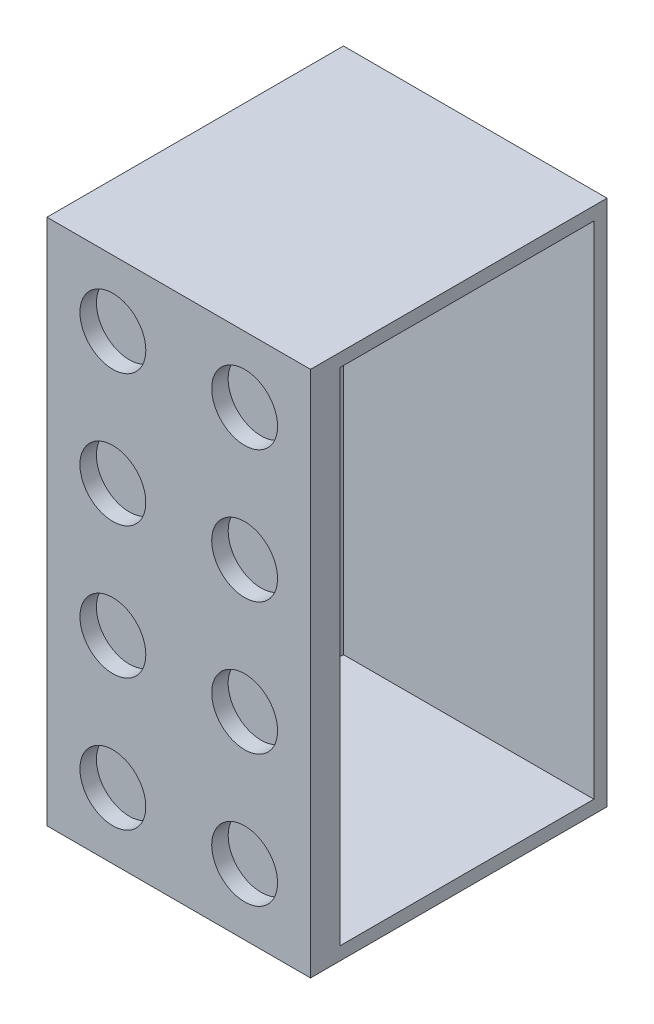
SolidWorks part; units mm, degrees
ref_plane "Front Plane" through (0, 0, 0) normal (0, 0, 1) x (1, 0, 0)
ref_plane "Top Plane" through (0, 0, 0) normal (0, 1, 0) x (1, 0, 0)
ref_plane "Right Plane" through (0, 0, 0) normal (1, 0, 0) x (0, 0, -1)
sketch "Sketch1" plane through (0, 0, 0) normal (0, 0, 1) x (1, 0, 0)
  line L1 (0, 0) -> (50.8, 0)
  line L2 (0, 0) -> (0, 101.6)
  line L3 (0, 101.6) -> (50.8, 101.6)
  line L4 (50.8, 0) -> (50.8, 101.6)
  dimension "D1" = 101.6
  dimension "D2" = 50.8
extrude "Boss-Extrude1" add sketch "Sketch1" along normal blind 57.15
sketch "Sketch3" plane through (0, 0, 57.15) normal (0, 0, 1) x (1, 0, 0)
  line L0 (0, 101.6) -> (0, 0) construction
  line L1 (50.8, 101.6) -> (0, 101.6) construction
  line L2 (0, 0) -> (50.8, 0) construction
  line L3 (25.4, 101.6) -> (25.4, 0)
  line L5 (12.7, 152.4) -> (12.7, 0)
  line L6 (38.1, 101.6) -> (38.1, 0)
  line L7 (50.8, 101.6) -> (50.8, 0)
  line L8 (63.5, 101.6) -> (63.5, 0)
  line L9 (76.2, 101.6) -> (76.2, 0)
  line L10 (88.9, 101.6) -> (88.9, 0)
  line L11 (0, 12.7) -> (50.8, 12.7)
  line L12 (50.8, 0) -> (50.8, 101.6) construction
  line L13 (0, 25.4) -> (50.8, 25.4)
  line L14 (0, 38.1) -> (50.8, 38.1)
  line L15 (0, 50.8) -> (50.8, 50.8)
  line L16 (0, 63.5) -> (50.8, 63.5)
  line L17 (0, 63.6141) -> (50.8, 63.6141)
  line L18 (0, 76.2) -> (50.8, 76.2)
  line L19 (0, 88.9) -> (50.8, 88.9)
  line L20 (0, 101.6) -> (50.8, 101.6)
  line L21 (0, 114.3) -> (50.8, 114.3)
  line L22 (0, 127) -> (50.8, 127)
  line L23 (0, 139.7) -> (50.8, 139.7)
  circle A0 centre (12.7, 139.7) radius 6.35
  circle A2 centre (38.1, 139.7) radius 6.35
  circle A4 centre (63.5, 139.7) radius 2.54
  circle A6 centre (88.9, 139.7) radius 2.54
  circle A7 centre (88.9, 114.3) radius 2.54
  circle A8 centre (63.5, 114.3) radius 2.54
  circle A9 centre (38.1, 114.3) radius 6.35
  circle A10 centre (12.7, 114.3) radius 6.35
  circle A11 centre (88.9, 88.9) radius 2.54
  circle A12 centre (63.5, 88.9) radius 2.54
  circle A13 centre (38.1, 88.9) radius 6.35
  circle A14 centre (12.7, 88.9) radius 6.35
  circle A15 centre (88.9, 63.5) radius 2.54
  circle A16 centre (63.5, 63.5) radius 2.54
  circle A17 centre (38.1, 63.5) radius 6.35
  circle A18 centre (12.7, 63.5) radius 6.35
  circle A19 centre (88.9, 38.1) radius 2.54
  circle A20 centre (63.5, 38.1) radius 2.54
  circle A21 centre (38.1, 38.1) radius 6.35
  circle A22 centre (12.7, 38.1) radius 6.35
  circle A23 centre (88.9, 12.7) radius 2.54
  circle A24 centre (63.5, 12.7) radius 2.54
  circle A25 centre (38.1, 12.7) radius 6.35
  circle A26 centre (12.7, 12.7) radius 6.35
  dimension "D1" = 12.7
  dimension "D2" = 12.7
  dimension "D3" = 12.7
  dimension "D4" = 12.7
  dimension "D5" = 12.7
  dimension "D6" = 12.7
  dimension "D7" = 12.7
  dimension "D8" = 12.7
  dimension "D9" = 12.7
  dimension "D10" = 12.7
  dimension "D11" = 12.7
  dimension "D12" = 12.7
  dimension "D13" = 12.7
  dimension "D14" = 12.7
  dimension "D15" = 12.7
  dimension "D16" = 12.7
  dimension "D17" = 12.7
  dimension "D18" = 12.7
extrude "Cut-Extrude2" cut sketch "Sketch3" against normal blind 3.175 contours A0 | A2 | A4 | A6 | A7 | A8 | A9 | A10 | A14 | A13 | A12 | A11 | A18 | A17 | A16 | A15 | A22 | A21 | A20 | A19 | A26 | A25 | A24 | A23
sketch "Sketch6" plane through (50.8, 0, 0) normal (1, 0, 0) x (0, 0, -1)
  line L0 (-51.435, 99.06) -> (-51.435, 2.54)
  line L1 (-51.435, 2.54) -> (-2.54, 2.54)
  line L2 (-2.54, 2.54) -> (-2.54, 99.06)
  line L3 (-2.54, 99.06) -> (-51.435, 99.06)
  line L4 (-57.15, 0) -> (-57.15, 101.6) construction
  line L5 (-57.15, 101.6) -> (0, 101.6) construction
  line L6 (-57.15, 0) -> (0, 0) construction
  line L7 (0, 0) -> (0, 101.6) construction
  dimension "D1" = 5.715
  dimension "D2" = 2.54
  dimension "D3" = 2.54
  dimension "D4" = 2.54
extrude "Cut-Extrude5" cut sketch "Sketch6" against normal blind 48.26
